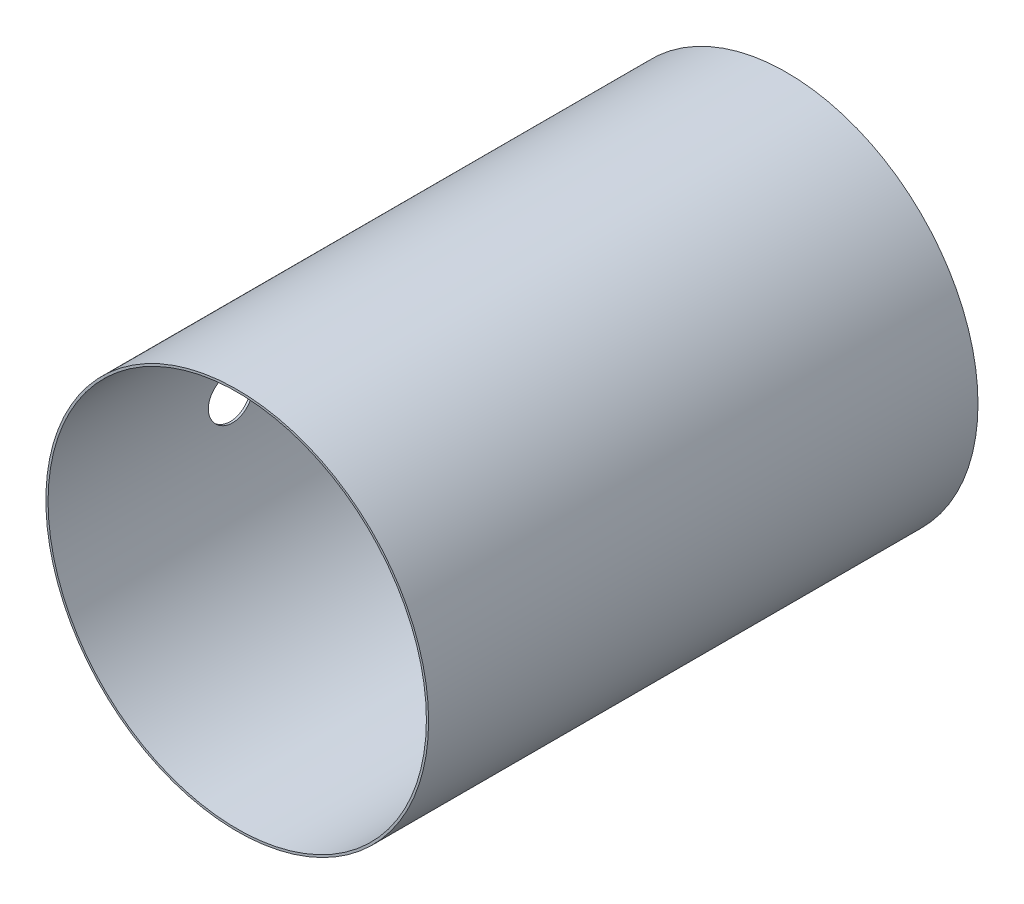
SolidWorks part; units mm, degrees
ref_plane "Plan1" through (0, 0, 0) normal (0, 0, 1) x (1, 0, 0)
ref_plane "Plan2" through (0, 0, 0) normal (0, 1, 0) x (1, 0, 0)
ref_plane "Plan3" through (0, 0, 0) normal (1, 0, 0) x (0, 0, -1)
sketch "Esquisse1" plane through (0, 0, 0) normal (0, 0, 1) x (1, 0, 0)
  circle A0 centre (0, 0) radius 522.5
  circle A1 centre (0, 0) radius 516.5
  dimension "D1" = 1045
  dimension "D2" = 1033
extrude "Base-Extrusion" add sketch "Esquisse1" along normal blind 1500
sketch "Esquisse2" plane through (0, 0, 0) normal (1, 0, 0) x (0, 0, -1)
  line L1 (0, -522.5) -> (0, 522.5) construction
  circle A0 centre (-1000, 0) radius 62.5
  circle A1 centre (-290, 0) radius 82.5
  dimension "D1" = 165
  dimension "D2" = 125
  dimension "D3" = 290
  dimension "D4" = 1000
extrude "Enlèv. mat.-Extru.1" cut sketch "Esquisse2" against normal through all
ref_plane "Plan4" through (0, 0, 1500) normal (0, 0, 1) x (1, 0, 0)
ref_plane "Plan5" through (0, 0, -10) normal (0, 0, -1) x (-1, 0, 0)
